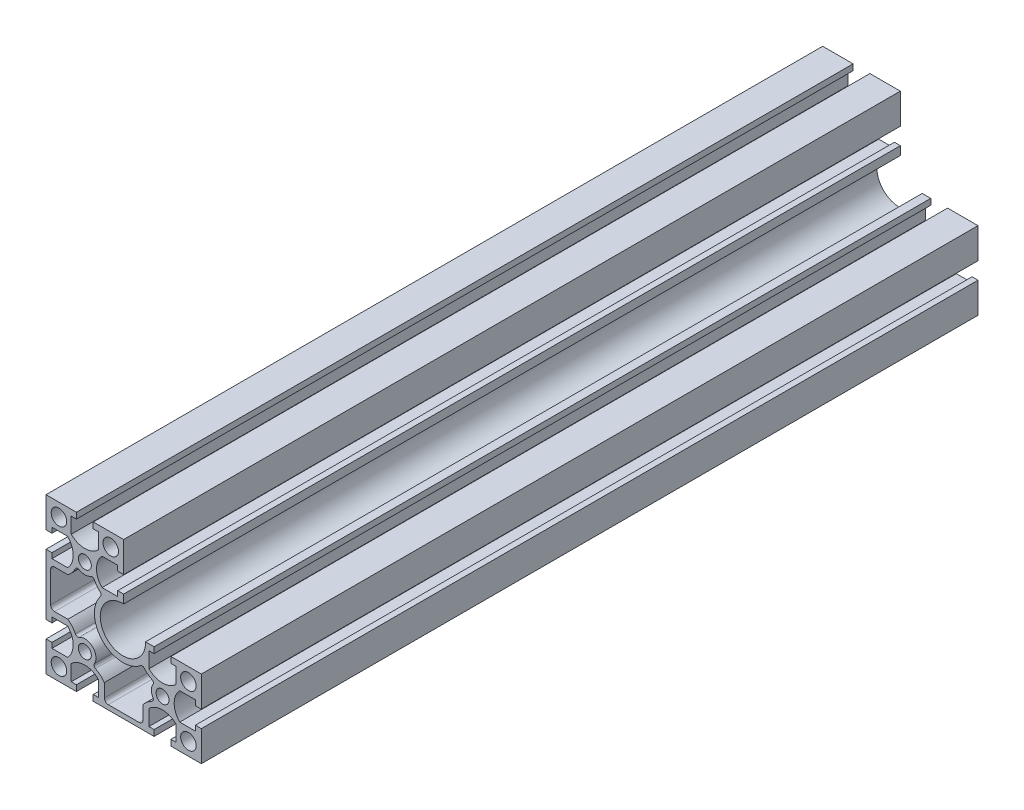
SolidWorks part; units mm, degrees
ref_plane "前视基准面" through (0, 0, 0) normal (0, 0, 1) x (1, 0, 0)
ref_plane "上视基准面" through (0, 0, 0) normal (0, 1, 0) x (1, 0, 0)
ref_plane "右视基准面" through (0, 0, 0) normal (1, 0, 0) x (0, 0, -1)
sketch "Model" plane through (0, 0, 0) normal (0, 0, 1) x (1, 0, 0)
  line L0 (1963.8532, 704.6573) -> (1958.723, 704.6573)
  line L1 (1957.223, 706.1573) -> (1957.223, 718.0573)
  line L2 (1958.723, 719.5573) -> (1963.8532, 719.5573)
  line L3 (1992.873, 690.5375) -> (1992.873, 685.4073)
  line L4 (1991.373, 683.9073) -> (1979.473, 683.9073)
  line L5 (1977.973, 685.4073) -> (1977.973, 690.5375)
  line L6 (1995.173, 709.8073) -> (1995.173, 703.7512)
  line L7 (2005.673, 703.7512) -> (2005.673, 709.8073)
  line L8 (2005.673, 709.8073) -> (2003.673, 709.8073)
  line L9 (2003.673, 709.8073) -> (2003.673, 712.1073)
  line L10 (2003.673, 712.1073) -> (2015.423, 712.1073)
  line L11 (2015.423, 712.1073) -> (2015.423, 700.3573)
  line L12 (2015.423, 700.3573) -> (2013.123, 700.3573)
  line L13 (2013.123, 700.3573) -> (2013.123, 702.3573)
  line L14 (2013.123, 702.3573) -> (2007.0669, 702.3573)
  line L15 (2007.0669, 691.8573) -> (2013.123, 691.8573)
  line L16 (2013.123, 691.8573) -> (2013.123, 693.8573)
  line L17 (2013.123, 693.8573) -> (2015.423, 693.8573)
  line L18 (2015.423, 693.8573) -> (2015.423, 682.1073)
  line L19 (2015.423, 682.1073) -> (2003.673, 682.1073)
  line L20 (2003.673, 682.1073) -> (2003.673, 684.4073)
  line L21 (2003.673, 684.4073) -> (2005.673, 684.4073)
  line L22 (2005.673, 684.4073) -> (2005.673, 690.4633)
  line L23 (1995.173, 690.4633) -> (1995.173, 684.4073)
  line L24 (1995.173, 684.4073) -> (1997.173, 684.4073)
  line L25 (1997.173, 684.4073) -> (1997.173, 682.1073)
  line L26 (1997.173, 682.1073) -> (1973.673, 682.1073)
  line L27 (1973.673, 682.1073) -> (1973.673, 684.4073)
  line L28 (1973.673, 684.4073) -> (1975.673, 684.4073)
  line L29 (1975.673, 684.4073) -> (1975.673, 690.4633)
  line L30 (1965.173, 690.4633) -> (1965.173, 684.4073)
  line L31 (1965.173, 684.4073) -> (1967.173, 684.4073)
  line L32 (1967.173, 684.4073) -> (1967.173, 682.1073)
  line L33 (1967.173, 682.1073) -> (1955.423, 682.1073)
  line L34 (1955.423, 682.1073) -> (1955.423, 693.8573)
  line L35 (1955.423, 693.8573) -> (1957.723, 693.8573)
  line L36 (1957.723, 693.8573) -> (1957.723, 691.8573)
  line L37 (1957.723, 691.8573) -> (1963.779, 691.8573)
  line L38 (1963.779, 702.3573) -> (1957.723, 702.3573)
  line L39 (1957.723, 702.3573) -> (1957.723, 700.3573)
  line L40 (1957.723, 700.3573) -> (1955.423, 700.3573)
  line L41 (1955.423, 700.3573) -> (1955.423, 723.8573)
  line L42 (1955.423, 723.8573) -> (1957.723, 723.8573)
  line L43 (1957.723, 723.8573) -> (1957.723, 721.8573)
  line L44 (1957.723, 721.8573) -> (1963.779, 721.8573)
  line L45 (1963.779, 732.3573) -> (1957.723, 732.3573)
  line L46 (1957.723, 732.3573) -> (1957.723, 730.3573)
  line L47 (1957.723, 730.3573) -> (1955.423, 730.3573)
  line L48 (1955.423, 730.3573) -> (1955.423, 742.1073)
  line L49 (1955.423, 742.1073) -> (1967.173, 742.1073)
  line L50 (1967.173, 742.1073) -> (1967.173, 739.8073)
  line L51 (1967.173, 739.8073) -> (1965.173, 739.8073)
  line L52 (1965.173, 739.8073) -> (1965.173, 733.7512)
  line L53 (1975.673, 733.7512) -> (1975.673, 739.8073)
  line L54 (1975.673, 739.8073) -> (1973.673, 739.8073)
  line L55 (1973.673, 739.8073) -> (1973.673, 742.1073)
  line L56 (1973.673, 742.1073) -> (1985.423, 742.1073)
  line L57 (1985.423, 742.1073) -> (1985.423, 730.3573)
  line L58 (1985.423, 730.3573) -> (1983.123, 730.3573)
  line L59 (1983.123, 730.3573) -> (1983.123, 732.3573)
  line L60 (1983.123, 732.3573) -> (1977.0669, 732.3573)
  line L61 (1977.0669, 721.8573) -> (1983.123, 721.8573)
  line L62 (1983.123, 721.8573) -> (1983.123, 723.8573)
  line L63 (1983.123, 723.8573) -> (1985.423, 723.8573)
  line L64 (1985.423, 723.8573) -> (1985.423, 720.5521)
  line L65 (1993.8678, 712.1073) -> (1997.173, 712.1073)
  line L66 (1997.173, 712.1073) -> (1997.173, 709.8073)
  line L67 (1997.173, 709.8073) -> (1995.173, 709.8073)
  circle A0 centre (1960.423, 687.1073) radius 3
  circle A1 centre (1970.423, 697.1073) radius 2.5
  circle A2 centre (1970.423, 727.1073) radius 2.5
  circle A3 centre (1960.423, 737.1073) radius 3
  circle A4 centre (1980.423, 737.1073) radius 3
  circle A5 centre (2010.423, 687.1073) radius 3
  circle A6 centre (2000.423, 697.1073) radius 2.5
  circle A7 centre (2010.423, 707.1073) radius 3
  arc A8 (1977.973, 690.5375) -> (1974.5138, 693.4592) centre (1970.423, 685.1073) ccw
  arc A9 (1974.0989, 694.8761) -> (1974.5138, 693.4592) centre (1974.9537, 694.3573) ccw
  arc A10 (1974.0989, 694.8761) -> (1968.1918, 700.7831) centre (1970.423, 697.1073) ccw
  arc A11 (1966.7749, 701.1981) -> (1968.1918, 700.7831) centre (1967.673, 701.638) ccw
  arc A12 (1966.7749, 701.1981) -> (1963.8532, 704.6573) centre (1958.423, 697.1073) ccw
  arc A13 (1957.223, 706.1573) -> (1958.723, 704.6573) centre (1958.723, 706.1573) ccw
  arc A14 (1958.723, 719.5573) -> (1957.223, 718.0573) centre (1958.723, 718.0573) ccw
  arc A15 (1963.8532, 719.5573) -> (1966.7749, 723.0164) centre (1958.423, 727.1073) ccw
  arc A16 (1968.1918, 723.4314) -> (1966.7749, 723.0164) centre (1967.673, 722.5765) ccw
  arc A17 (1968.1918, 723.4314) -> (1972.6541, 723.4314) centre (1970.423, 727.1073) ccw
  arc A18 (1974.071, 723.0164) -> (1972.6541, 723.4314) centre (1973.173, 722.5765) ccw
  arc A19 (1974.071, 723.0164) -> (1976.381, 720.0373) centre (1982.423, 727.1073) ccw
  arc A20 (1976.514, 718.6546) -> (1976.381, 720.0373) centre (1975.7314, 719.277) ccw
  arc A21 (1976.514, 718.6546) -> (1991.9703, 703.1983) centre (1985.123, 711.8073) ccw
  arc A22 (1993.353, 703.0653) -> (1991.9703, 703.1983) centre (1992.5928, 702.4156) ccw
  arc A23 (1993.353, 703.0653) -> (1996.3321, 700.7553) centre (2000.423, 709.1073) ccw
  arc A24 (1996.7471, 699.3384) -> (1996.3321, 700.7553) centre (1995.8922, 699.8573) ccw
  arc A25 (1996.7471, 699.3384) -> (1996.7471, 694.8761) centre (2000.423, 697.1073) ccw
  arc A26 (1996.3321, 693.4592) -> (1996.7471, 694.8761) centre (1995.8922, 694.3573) ccw
  arc A27 (1996.3321, 693.4592) -> (1992.873, 690.5375) centre (2000.423, 685.1073) ccw
  arc A28 (1991.373, 683.9073) -> (1992.873, 685.4073) centre (1991.373, 685.4073) ccw
  arc A29 (1977.973, 685.4073) -> (1979.473, 683.9073) centre (1979.473, 685.4073) ccw
  arc A30 (1995.173, 703.7512) -> (2005.673, 703.7512) centre (2000.423, 709.1073) ccw
  arc A31 (2007.0669, 702.3573) -> (2007.0669, 691.8573) centre (2012.423, 697.1073) ccw
  arc A32 (2005.673, 690.4633) -> (1995.173, 690.4633) centre (2000.423, 685.1073) ccw
  arc A33 (1975.673, 690.4633) -> (1965.173, 690.4633) centre (1970.423, 685.1073) ccw
  arc A34 (1963.779, 691.8573) -> (1963.779, 702.3573) centre (1958.423, 697.1073) ccw
  arc A35 (1963.779, 721.8573) -> (1963.779, 732.3573) centre (1958.423, 727.1073) ccw
  arc A36 (1965.173, 733.7512) -> (1975.673, 733.7512) centre (1970.423, 739.1073) ccw
  arc A37 (1977.0669, 732.3573) -> (1977.0669, 721.8573) centre (1982.423, 727.1073) ccw
  arc A38 (1985.423, 720.5521) -> (1993.8678, 712.1073) centre (1985.123, 711.8073) ccw
extrude "凸台-拉伸1" add sketch "Model" along normal blind 300
